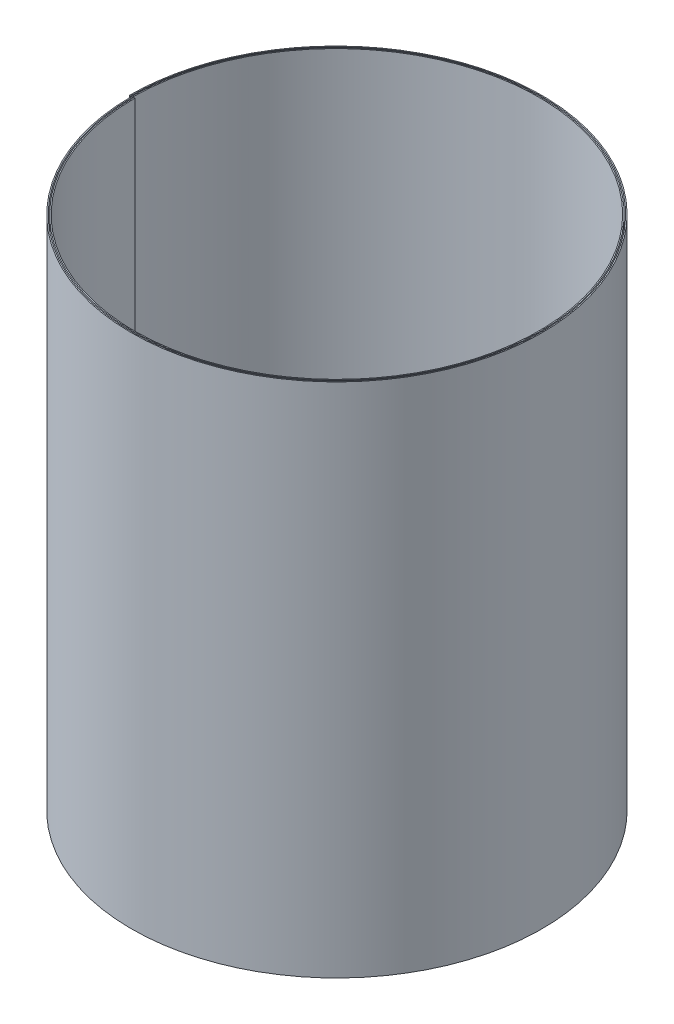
SolidWorks part; units mm, degrees
ref_plane "Front" through (0, 0, 0) normal (0, 0, 1) x (1, 0, 0)
ref_plane "Top" through (0, 0, 0) normal (0, 1, 0) x (1, 0, 0)
ref_plane "Right" through (0, 0, 0) normal (1, 0, 0) x (0, 0, -1)
sketch "Sketch1" plane through (0, 0, 0) normal (0, 1, 0) x (1, 0, 0)
  circle A0 centre (0, 0) radius 400
  dimension "D1" = 800
curve "Helix/Spiral1"
sketch "Sketch2" plane through (0, 0, 0) normal (0, 1, 0) x (1, 0, 0)
  circle A0 centre (0, 0) radius 395.99
  circle A1 centre (0, 0) radius 400 construction
  point P5 (-395.99, 0)
curve "Helix/Spiral2"
curve "CompCurve1"
ref_plane "Plane1" through (0, 1000, 0) normal (0, 1, 0) x (-1, 0, 0)
sketch "Sketch3" plane through (0, 1000, 0) normal (0, 1, 0) x (-1, 0, 0)
  spline S4 degree 3 number of poles 130 (395.99, 0) -> (391.98, 0)
  spline S5 degree 3 number of poles 130 (400, 0) -> (395.99, 0)
  spline S6 degree 3 number of poles 130 (395.99, 0) -> (391.98, 0)
  spline S7 degree 3 number of poles 130 (400, 0) -> (395.99, 0)
  dimension "D1" = 0
sketch "Sketch8" plane through (0, 0, 0) normal (0, 1, 0) x (1, 0, 0)
  spline S2 degree 3 number of poles 130 (-395.99, 0) -> (-391.98, 0)
  spline S3 degree 3 number of poles 130 (-400, 0) -> (-395.99, 0)
  spline S4 degree 3 number of poles 130 (-395.99, 0) -> (-391.98, 0)
  spline S5 degree 3 number of poles 130 (-400, 0) -> (-395.99, 0)
  dimension "D1" = 0
sheet metal parameters "Sheet-Metal2" thickness 2 parameters "D1"=2, "Dicke"=2
lofted bend "Lofted Bends3" parameters "D1"=0, "D12"=2
other "Freeform Bend1" parameters "D1"=1000, "D4"=57.296, "D5"=1
other "Freeform Bend2" parameters "D1"=1000, "D4"=57.296, "D5"=2
flat pattern "Flat-Pattern1"
sketch "Sketch10" plane through (0, 0, 0) normal (0, 1, 0) x (-1, 0, 0)
other "Flatten-<Freeform Bend1>1"
other "Flatten-<Freeform Bend2>1"
